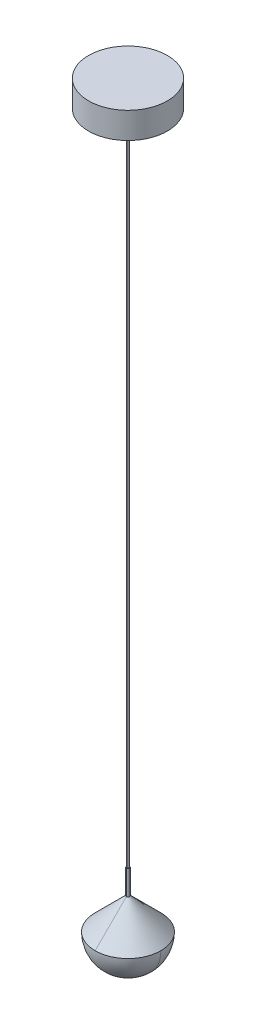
SolidWorks part; units mm, degrees
ref_plane "Alzado" through (0, 0, 0) normal (0, 0, 1) x (1, 0, 0)
ref_plane "Planta" through (0, 0, 0) normal (0, 1, 0) x (1, 0, 0)
ref_plane "Vista lateral" through (0, 0, 0) normal (1, 0, 0) x (0, 0, -1)
imported_body "C1275.IGS<1>"
ref_plane "Plano1" through (0, 1155, 0) normal (0, 1, 0) x (1, 0, 0)
sketch "Croquis2" plane through (0, 1155, 0) normal (0, 1, 0) x (1, 0, 0)
  circle A0 centre (0, 0) radius 59.944
  dimension "D1" = 119.888
extrude "Saliente-Extruir1" add sketch "Croquis2" along normal blind 39.878
